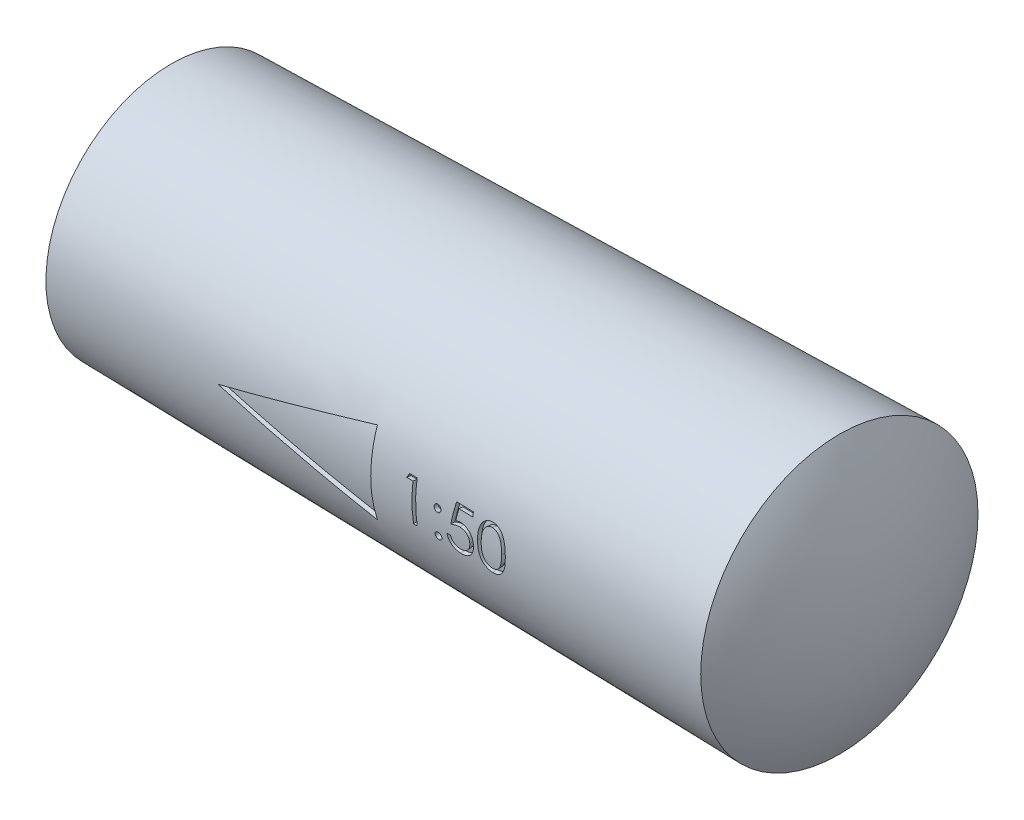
SolidWorks part; units mm, degrees
ref_plane "Front Plane" through (0, 0, 0) normal (0, 0, 1) x (1, 0, 0)
ref_plane "Top Plane" through (0, 0, 0) normal (0, 1, 0) x (1, 0, 0)
ref_plane "Right Plane" through (0, 0, 0) normal (1, 0, 0) x (0, 0, -1)
sketch "Sketch1" plane through (0, 0, 0) normal (1, 0, 0) x (0, 0, -1)
  circle A0 centre (0, 0) radius 3
  dimension "D1" = 6
extrude "Extrude1" add sketch "Sketch1" along normal mid plane 16
draft "Draft1" type of draft neutral plane draft angle 1.146 faces to draft 1 parameters "D1"=1.146
sketch "Sketch2" plane through (0, 0, 0) normal (0, 0, 1) x (1, 0, 0)
  line L0 (-8, 0) -> (-8, 3)
  line L1 (-8, 3) -> (-8, -3) construction
  line L2 (-8, 0) -> (-8.9, 0)
  line L3 (-8.9, 0) -> (-8.9, -3.16) construction
  line L4 (8, 0) -> (8, 3.32)
  line L5 (8, -3.32) -> (8, 3.32) construction
  line L6 (8, 0) -> (8.9, 0)
  line L7 (8.9, 0) -> (8.9, -3.16) construction
  line L8 (-8, -3) -> (8, -3.32) construction
  arc A0 (-8.9, 0) -> (-8, 3) centre (-3.45, 0) cw
  arc A1 (8.9, 0) -> (8, 3.32) centre (2.3264, 0) ccw
  point P14 (0, -3.16)
revolve "Revolve1" add sketch "Sketch2" angle 360 about L2
sketch "Sketch5" plane through (0, 0, 0) normal (0, 0, 1) x (1, 0, 0)
  line L0 (0, 3.16) -> (0, -3.16) construction
  line L1 (8, 3.32) -> (-8, 3) construction
  line L2 (-8, -3) -> (8, -3.32) construction
ref_plane "Plane2" through (0, 0, 0) normal (-0.02, 0, 0.9998) x (0.9998, 0, 0.02)
sketch "Sketch6" plane through (0, 0, 0) normal (-0.02, 0, 0.9998) x (0.9998, 0, 0.02)
  line L0 (0, 0) -> (0, 1)
  line L1 (0, 3.16) -> (0, -3.16) construction
  line L2 (0, 1) -> (-3.7321, 0)
  line L3 (-3.7321, 0) -> (0, -1)
  line L4 (0, -1) -> (0, 0)
  line L5 (0, -0.5) -> (4, -0.5) construction
  text T0 "1:50" font "Century Gothic" height 1
  dimension "D1" = 2
  dimension "D2" = 30
  dimension "D3" = 4
wrap "Wrap2" sketch "Sketch6" wrap type deboss source sketch "Sketch6" thickness 0.1 parameters "D1"=0.1
equation "\"D2@Sketch2\" = \"D1@Sketch2\""
